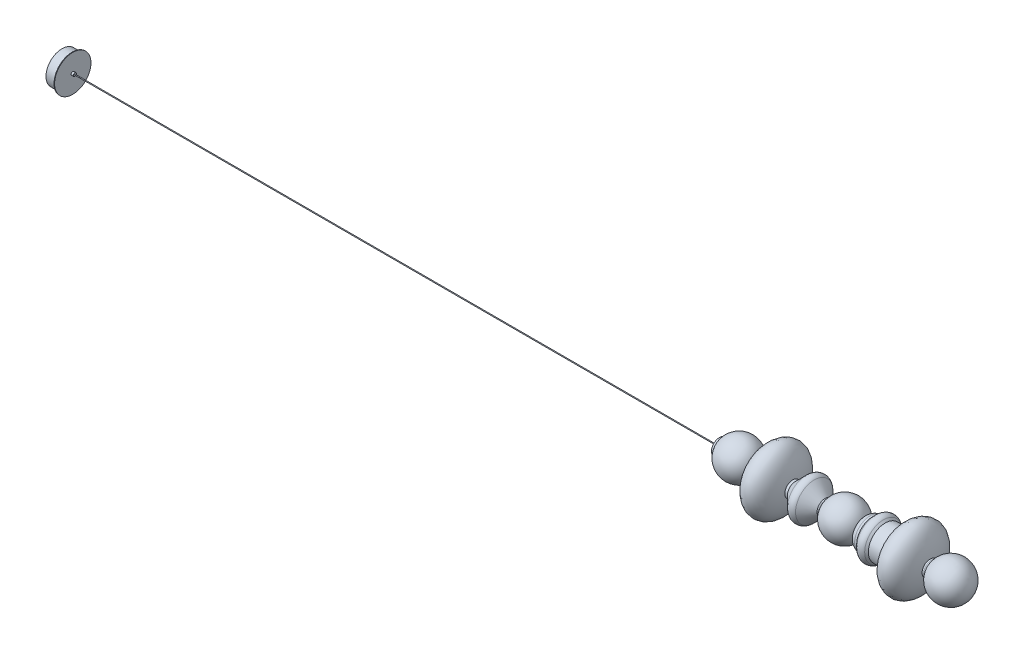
SolidWorks part; units mm, degrees
ref_plane "Alzado" through (0, 0, 0) normal (0, 0, 1) x (1, 0, 0)
ref_plane "Planta" through (0, 0, 0) normal (0, 1, 0) x (1, 0, 0)
ref_plane "Vista lateral" through (0, 0, 0) normal (1, 0, 0) x (0, 0, -1)
sketch "Croquis1" plane through (0, 0, 0) normal (0, 0, 1) x (1, 0, 0)
  line L0 (-82.5, 0) -> (82.5, 0)
  line L1 (-82.5, 103.993) -> (-82.5, 0) construction
  line L2 (82.5, 116.0803) -> (82.5, 35.9687) construction
  line L3 (82.5, 0) -> (82.5, -116.9372) construction
  line L4 (-82.5, 35.9687) -> (-82.5, 0)
  line L5 (82.5, 35.9687) -> (82.5, 0)
  arc A0 (82.5, 35.9687) -> (-82.5, 35.9687) centre (0, 0) ccw
  dimension "D1" = 180
  dimension "D2" = 82.5
  dimension "D3" = 165
revolve "Revolución1" add sketch "Croquis1" angle 360 about L0
sketch "Croquis2" plane through (0, 0, 0) normal (0, 0, 1) x (1, 0, 0)
  line L0 (0, 0) -> (577.9569, 0) construction
  line L1 (235.5, 28.0307) -> (235.5, -954.667) construction
  line L3 (87.5, 0) -> (87.5, 37.5)
  line L4 (107.7869, 80) -> (520.2734, 80) construction
  line L5 (383.5, 0) -> (383.5, 37.5)
  line L8 (87.5, 0) -> (383.5, 0)
  line L11 (82.5, -35.9687) -> (82.5, 35.9687) construction
  arc A1 (118.6884, 72.7911) -> (87.5, 37.5) centre (123.0609, 37.5) ccw
  arc A2 (383.5, 37.5) -> (352.3116, 72.7911) centre (347.9391, 37.5) ccw
  arc A3 (352.3116, 72.7911) -> (118.6884, 72.7911) centre (235.5, -870) ccw
  point P8 (82.5, 0)
  dimension "D3" = 1900
  dimension "D4" = 37.5
  dimension "D5" = 296
  dimension "D6" = 80
  dimension "D1" = 5
revolve "Revolución2" add sketch "Croquis2" angle 360 about L8
sketch "Croquis3" plane through (0, 0, 0) normal (0, 0, 1) x (1, 0, 0)
  line L0 (0, 0) -> (875.0701, 0) construction
  line L1 (92.5, 37) -> (142.7218, 87.2218)
  line L3 (180.2782, 87.2218) -> (230.5, 37)
  line L5 (768.249, 95) -> (318.4197, 95) construction
  line L6 (92.5, 0) -> (92.5, 37)
  line L7 (230.5, 0) -> (230.5, 37)
  line L8 (92.5, 0) -> (230.5, 0)
  line L12 (82.5, -35.9687) -> (82.5, 35.9687) construction
  arc A0 (180.2782, 87.2218) -> (142.7218, 87.2218) centre (161.5, 68.4437) ccw
  point P4 (161.5, 0)
  dimension "D1" = 95
  dimension "D2" = 138
  dimension "D3" = 10
  dimension "D4" = 37
  dimension "D5" = 90
revolve "Revolución3" add sketch "Croquis3" angle 360 about L8
sketch "Croquis8" plane through (0, 0, 0) normal (0, 0, 1) x (1, 0, 0)
  line L0 (0, 0) -> (818.4274, 0) construction
  line L1 (230.5, -37) -> (230.5, 37) construction
  line L2 (240.5, 0) -> (400.5, 0)
  ellipse E0 centre (320.5, 0) end of major axis (320.5, 150) minor radius 80 (400.5, 0) -> (240.5, 0) ccw
  dimension "D1" = 160
  dimension "D2" = 300
  dimension "D3" = 10
revolve "Revolución6" add sketch "Croquis8" angle 360 about L0
sketch "Croquis10" plane through (0, 0, 0) normal (0, 0, 1) x (1, 0, 0)
  line L0 (0, 0) -> (235.5, 0) construction
  line L1 (82.5, -35.9687) -> (82.5, 35.9687) construction
  line L2 (82.5, 0) -> (92.5, 0)
  line L3 (82.5, 0) -> (82.5, 37)
  line L4 (82.5, 37) -> (92.5, 37)
  line L5 (92.5, 0) -> (92.5, 37)
  line L6 (235.5, 0) -> (235.5, 37)
  line L7 (230.5, 37) -> (235.5, 37)
  line L8 (230.5, 37) -> (230.5, 0)
  line L9 (230.5, 0) -> (235.5, 0)
  line L11 (400.6242, 0) -> (410.6242, 0)
  line L12 (400.6242, 0) -> (400.6242, 37)
  line L13 (400.6242, 37) -> (410.6242, 37)
  line L14 (410.6242, 0) -> (410.6242, 37)
  line L15 (240.5, 0) -> (476.4351, 0) construction
  dimension "D2" = 10
  dimension "D3" = 37
revolve "Revolución8" add sketch "Croquis10" angle 360 about L0
sketch "Croquis9" plane through (0, 0, 0) normal (0, 0, 1) x (1, 0, 0)
  line L0 (0, 0) -> (633.0272, 0) construction
  line L1 (410.6242, 30) -> (410.6242, 0)
  line L2 (410.6242, 0) -> (585.477, 0)
  line L3 (410.6242, -37) -> (410.6242, 37) construction
  arc A0 (585.477, 0) -> (410.6242, 30) centre (495.477, 0) ccw
  point P6 (398.5194, 0)
  dimension "D1" = 180
  dimension "D2" = 30
revolve "Revolución7" add sketch "Croquis9" angle 360 about L2
mirror "Simetría3" about plane through (0, 0, 0) normal (1, 0, 0)
sketch "Croquis11" plane through (0, 0, 0) normal (0, 1, 0) x (1, 0, 0)
  line L3 (233, -37) -> (233, 37) construction
  line L4 (230.5, -37) -> (235.5, -37) construction
  line L5 (235.5, 37) -> (230.5, 37) construction
  circle A0 centre (233, 0) radius 5
  dimension "D1" = 10
sketch "Croquis13" plane through (0, 0, 0) normal (0, 0, 1) x (1, 0, 0)
  line L0 (-82.5, 0) -> (-410.6242, 0) construction
  line L9 (-410.6242, 37) -> (-410.6242, -37) construction
  line L10 (-246.5621, 256.3884) -> (-246.5621, -256.3884)
  line L11 (-82.5, -37) -> (-82.5, 37) construction
  point P10 (320.5621, 0)
  point P13 (-246.5621, 0)
ref_plane "Plano2" through (-246.5621, 0, 0) normal (1, 0, 0) x (0, 0, -1)
mirror "Simetría6" about plane through (-246.5621, 0, 0) normal (1, 0, 0)
sketch "Croquis14" plane through (0, 0, 0) normal (0, 0, 1) x (1, 0, 0)
  line L0 (-410.6242, 0) -> (-575.6242, 0) construction
  line L1 (-575.6242, 35.9687) -> (-575.6242, -35.9687) construction
  line L2 (-493.1242, -117.4687) -> (-493.1242, 117.4687)
  point P8 (-493.1242, 0)
ref_plane "Plano3" through (-493.1242, 0, 0) normal (1, 0, 0) x (0, 0, -1)
mirror "Simetría7" about plane through (-493.1242, 0, 0) normal (1, 0, 0)
sketch "Croquis15" plane through (-585.6242, 0, 0) normal (-1, 0, 0) x (0, 0, 1)
  circle A0 centre (0, 0) radius 6
  dimension "D1" = 12
extrude "Saliente-Extruir1" add sketch "Croquis15" along normal blind 10
sketch "Croquis16" plane through (-595.6242, 0, 0) normal (-1, 0, 0) x (0, 0, 1)
  circle A0 centre (0, 0) radius 1.75
  dimension "D1" = 3.5
extrude "Saliente-Extruir2" add sketch "Croquis16" along normal blind 3000
sketch "Croquis17" plane through (-3595.6242, 0, 0) normal (-1, 0, 0) x (0, 0, 1)
  circle A0 centre (0, 0) radius 7.5
  dimension "D1" = 15
extrude "Saliente-Extruir3" add sketch "Croquis17" along normal blind 10
sketch "Croquis18" plane through (-3605.6242, 0, 0) normal (-1, 0, 0) x (0, 0, 1)
  circle A0 centre (0, 0) radius 84.963
  dimension "D1" = 169.926
extrude "Saliente-Extruir4" add sketch "Croquis18" along normal blind 2.54
sketch "Croquis19" plane through (235.5, 0, 0) normal (1, 0, 0) x (0, 0, -1)
  circle A1 centre (0, 0) radius 37
  circle A2 centre (0, 0) radius 37
  dimension "D1" = 0
extrude "Saliente-Extruir5" add sketch "Croquis19" along normal up to next
sketch "Croquis20" plane through (-235.5, 0, 0) normal (-1, 0, 0) x (0, 0, 1)
  circle A1 centre (0, 0) radius 37
  circle A2 centre (0, 0) radius 37
  dimension "D1" = 0
extrude "Saliente-Extruir6" add sketch "Croquis20" along normal up to next
sketch "Croquis21" plane through (-400.6242, 0, 0) normal (1, 0, 0) x (0, 0, -1)
  circle A1 centre (0, 0) radius 37
  circle A2 centre (0, 0) radius 37
  dimension "D1" = 0
extrude "Saliente-Extruir7" add sketch "Croquis21" along normal up to next
sketch "Croquis22" plane through (400.6242, 0, 0) normal (-1, 0, 0) x (0, 0, 1)
  circle A1 centre (0, 0) radius 37
  circle A2 centre (0, 0) radius 37
  dimension "D1" = 0
extrude "Saliente-Extruir8" add sketch "Croquis22" along normal up to next
sketch "Croquis23" plane through (410.6242, 0, 0) normal (1, 0, 0) x (0, 0, -1)
  circle A1 centre (0, 0) radius 37
  circle A2 centre (0, 0) radius 37
  dimension "D1" = 0
extrude "Saliente-Extruir9" add sketch "Croquis23" along normal up to next
sketch "Croquis24" plane through (0, 0, 0) normal (0, 1, 0) x (1, 0, 0)
  line L0 (405.7312, -37) -> (405.7312, 37)
  line L3 (398.028, -37) -> (413.4343, -37) construction
  line L4 (413.4343, 37) -> (398.028, 37) construction
  line L5 (87.5, -37) -> (87.5, 37)
  line L6 (82.5, -37) -> (92.5, -37) construction
  line L7 (92.5, 37) -> (82.5, 37) construction
  line L8 (-87.5, -37) -> (-87.5, 37)
  line L9 (-92.5, -37) -> (-82.5, -37) construction
  line L10 (-82.5, 37) -> (-92.5, 37) construction
  line L11 (-404.3261, -37) -> (-404.3261, 37)
  line L12 (-410.6242, -37) -> (-398.028, -37) construction
  line L13 (-398.028, 37) -> (-410.6242, 37) construction
sketch "Croquis25" plane through (-3608.1642, 0, 0) normal (-1, 0, 0) x (0, 0, 1)
  circle A0 centre (0, 0) radius 75.057
  dimension "D1" = 150.114
extrude "Saliente-Extruir10" add sketch "Croquis25" along normal blind 47.498
